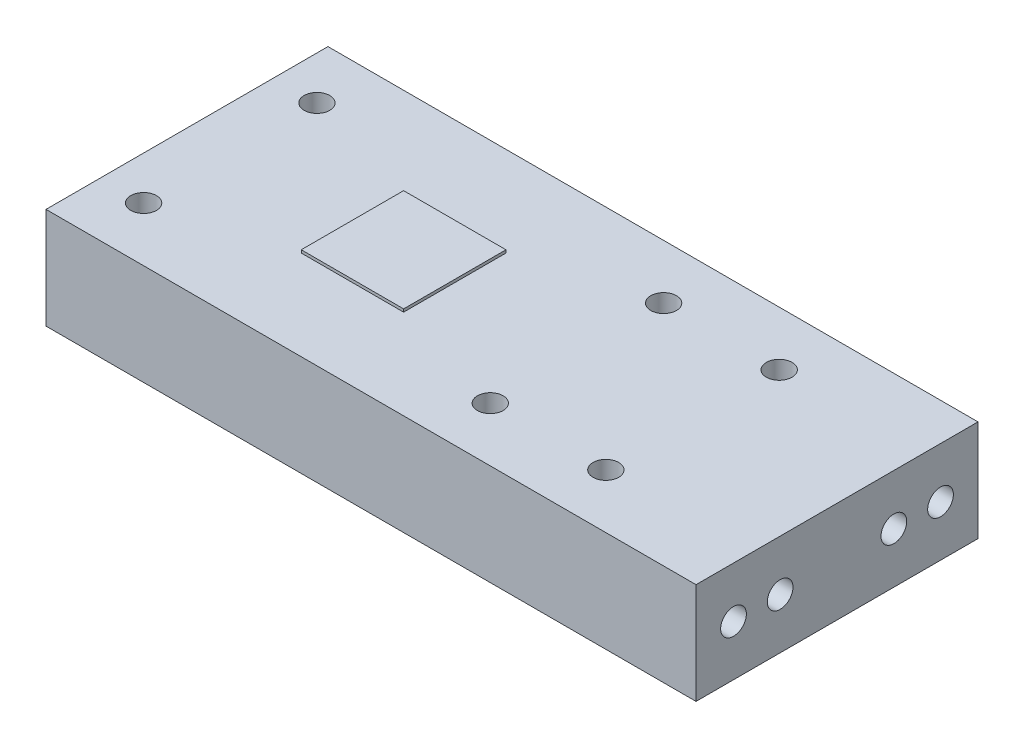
SolidWorks part; units mm, degrees
ref_plane "Front Plane" through (0, 0, 0) normal (0, 0, 1) x (1, 0, 0)
ref_plane "Top Plane" through (0, 0, 0) normal (0, 1, 0) x (1, 0, 0)
ref_plane "Right Plane" through (0, 0, 0) normal (1, 0, 0) x (0, 0, -1)
sketch "Sketch1" plane through (0, 0, 0) normal (0, 0, 1) x (1, 0, 0)
  line L0 (0, 0) -> (57.15, 0)
  line L1 (57.15, 0) -> (57.15, 8.89)
  line L4 (57.15, 8.89) -> (0, 8.89)
  line L5 (0, 8.89) -> (0, 0)
  dimension "D1" = 57.15
  dimension "D3" = 8.89
extrude "Boss-Extrude1" add sketch "Sketch1" along normal blind 24.7904
sketch "Sketch2" plane through (0, 8.89, 0) normal (0, 1, 0) x (1, 0, 0)
  line L1 (14.5462, -16.8952) -> (23.5462, -16.8952)
  line L2 (14.5462, -16.8952) -> (14.5462, -7.8952)
  line L3 (14.5462, -7.8952) -> (23.5462, -7.8952)
  line L4 (23.5462, -16.8952) -> (23.5462, -7.8952)
  line L5 (14.5462, -16.8952) -> (23.5462, -7.8952) construction
  line L6 (14.5462, -7.8952) -> (23.5462, -16.8952) construction
  point P0 (19.0462, -12.3952)
  point P5 (0, 0)
  point P6 (0, 0)
  point P7 (0, 0)
  point P12 (0, 0)
  point P17 (0, 0)
  point P18 (0, 0)
  point P19 (0, 0)
  point P20 (0, 0)
  point P21 (0, 0)
  point P22 (0, 0)
  point P23 (0, 0)
  point P24 (0, 0)
  point P25 (0, 0)
  point P26 (0, 0)
  point P28 (0, 0)
extrude "Boss-Extrude2" add sketch "Sketch2" along normal blind 0.25
sketch "Sketch4" plane through (0, 0, 0) normal (-1, 0, 0) x (0, 0, 1)
  line L0 (24.7904, 0) -> (0, 0) construction
  line L1 (0, 8.89) -> (24.7904, 8.89) construction
  line L2 (0, 8.89) -> (0, 0) construction
  line L3 (0, 0) -> (24.7904, 0) construction
  line L4 (24.7904, 8.89) -> (24.7904, 0) construction
  line L5 (0, 8.89) -> (24.7904, 0) construction
  line L6 (0, 0) -> (24.7904, 8.89) construction
  line L7 (24.7904, 8.89) -> (24.7904, 0) construction
  point P0 (12.3952, 4.445)
hole_wizard "#4-40 Tapped Hole1" positions "Sketch5" profile "Sketch7" tap size "#4-40" standard "ANSI Inch"
sketch "Sketch5" plane through (0, 0, 0) normal (-1, 0, 0) x (0, 0, 1)
  point P0 (12.3952, 4.445)
sketch "Sketch7" plane through (0, 4.445, 12.3952) normal (0, 1, 0) x (0, 0, 1)
  line L0 (0, 0) -> (0, 8.2992)
  line L1 (0, 8.2992) -> (1.1303, 7.62)
  line L2 (1.1303, 7.62) -> (1.1303, 0)
  line L5 (1.1303, 0) -> (0, 0)
  line L10 (0, 8.2992) -> (-1.1303, 7.62) construction
  line L11 (0, -6.35) -> (0, 107.95) construction
  dimension "Tap Drill Dia." = 2.2606
  dimension "Tap Drill Depth" = 7.62
  dimension "Drill Angle" = 118
sketch "Sketch8" plane through (0, 9.14, 0) normal (0, 1, 0) x (1, 0, 0)
  line L0 (14.5462, -7.8952) -> (14.5462, -16.8952) construction
  line L1 (14.5462, -7.8952) -> (23.5462, -7.8952) construction
  line L2 (14.5462, -7.8952) -> (14.5462, -16.8952) construction
  line L3 (14.5462, -16.8952) -> (23.5462, -16.8952) construction
  line L4 (23.5462, -7.8952) -> (23.5462, -16.8952) construction
  line L5 (14.5462, -7.8952) -> (23.5462, -16.8952) construction
  line L6 (14.5462, -16.8952) -> (23.5462, -7.8952) construction
  line L7 (14.5462, -16.8952) -> (23.5462, -16.8952) construction
  point P0 (19.0462, -12.3952)
sketch "Sketch9" plane through (0, 8.89, 0) normal (0, 1, 0) x (1, 0, 0)
  line L1 (3.8062, -20.0152) -> (34.2862, -20.0152) construction
  line L2 (3.8062, -20.0152) -> (3.8062, -4.7752) construction
  line L3 (3.8062, -4.7752) -> (34.2862, -4.7752) construction
  line L4 (34.2862, -20.0152) -> (34.2862, -4.7752) construction
  line L5 (3.8062, -20.0152) -> (34.2862, -4.7752) construction
  line L6 (3.8062, -4.7752) -> (34.2862, -20.0152) construction
  line L7 (44.4462, -4.7752) -> (-6.3538, -4.7752) construction
  line L8 (44.4462, -4.7752) -> (44.4462, -20.0152) construction
  line L9 (44.4462, -20.0152) -> (-6.3538, -20.0152) construction
  line L10 (-6.3538, -4.7752) -> (-6.3538, -20.0152) construction
  line L11 (44.4462, -4.7752) -> (-6.3538, -20.0152) construction
  line L12 (44.4462, -20.0152) -> (-6.3538, -4.7752) construction
  point P0 (19.0462, -12.3952)
  point P7 (19.0462, -12.3952)
  dimension "D1" = 15.24
  dimension "D2" = 30.48
  dimension "D3" = 50.8
  dimension "D4" = 15.24
hole_wizard "#4-40 Tapped Hole2" positions "Sketch10" profile "Sketch11" tap size "#4-40" standard "ANSI Inch"
sketch "Sketch10" plane through (0, 8.89, 0) normal (0, 1, 0) x (1, 0, 0)
  point P0 (3.8062, -4.7752)
  point P3 (34.2862, -4.7752)
  point P6 (34.2862, -20.0152)
  point P9 (3.8062, -20.0152)
  point P19 (-6.3538, -20.0152)
  point P22 (-6.3538, -4.7752)
sketch "Sketch11" plane through (3.8062, 8.89, 4.7752) normal (1, 0, 0) x (0, 0, 1)
  line L0 (0, 0) -> (0, 9.5692)
  line L1 (0, 9.5692) -> (1.1303, 8.89)
  line L2 (1.1303, 8.89) -> (1.1303, 0)
  line L5 (1.1303, 0) -> (0, 0)
  line L10 (0, 9.5692) -> (-1.1303, 8.89) construction
  line L11 (0, -6.35) -> (0, 107.95) construction
  dimension "Tap Drill Dia." = 2.2606
  dimension "Tap Drill Depth" = 8.89
  dimension "Drill Angle" = 118
hole_wizard "#4-40 Tapped Hole3" positions "Sketch12" profile "Sketch13" tap size "#4-40" standard "ANSI Inch"
sketch "Sketch12" plane through (0, 8.89, 0) normal (0, 1, 0) x (1, 0, 0)
  point P0 (44.4462, -20.0152)
  point P3 (44.4462, -4.7752)
sketch "Sketch13" plane through (44.4462, 8.89, 20.0152) normal (1, 0, 0) x (0, 0, 1)
  line L0 (0, 0) -> (0, 8.89)
  line L1 (0, 8.89) -> (1.1303, 8.89)
  line L2 (1.1303, 8.89) -> (1.1303, 0)
  line L5 (1.1303, 0) -> (0, 0)
  line L11 (0, -6.35) -> (0, 107.95) construction
  dimension "Thru Tap Drill Dia." = 2.2606
  dimension "Thru Tap Drill Depth" = 8.89
hole_wizard "#4-40 Tapped Hole4" positions "Sketch14" profile "Sketch15" tap size "#4-40" standard "ANSI Inch"
sketch "Sketch14" plane through (57.15, 0, 0) normal (1, 0, 0) x (0, 0, -1)
  line L0 (-24.7904, 4.445) -> (0, 4.445) construction
  line L1 (-24.7904, 0) -> (-24.7904, 8.89) construction
  line L2 (0, 0) -> (0, 8.89) construction
  line L4 (-12.3952, 0) -> (-12.3952, 8.89) construction
  line L5 (-24.7904, 0) -> (0, 0) construction
  line L6 (-24.7904, 8.89) -> (0, 8.89) construction
  point P0 (-17.3952, 4.445)
  point P2 (-7.3952, 4.445)
  point P25 (-21.4952, 4.445)
  point P28 (-3.2952, 4.445)
  dimension "D1" = 10
  dimension "D2" = 14.1
  dimension "D3" = 14.1
sketch "Sketch15" plane through (57.15, 4.445, 17.3952) normal (0, 1, 0) x (0, 0, -1)
  line L0 (0, 0) -> (0, 8.2992)
  line L1 (0, 8.2992) -> (1.1303, 7.62)
  line L2 (1.1303, 7.62) -> (1.1303, 0)
  line L5 (1.1303, 0) -> (0, 0)
  line L10 (0, 8.2992) -> (-1.1303, 7.62) construction
  line L11 (0, -6.35) -> (0, 107.95) construction
  dimension "Tap Drill Dia." = 2.2606
  dimension "Tap Drill Depth" = 7.62
  dimension "Drill Angle" = 118
